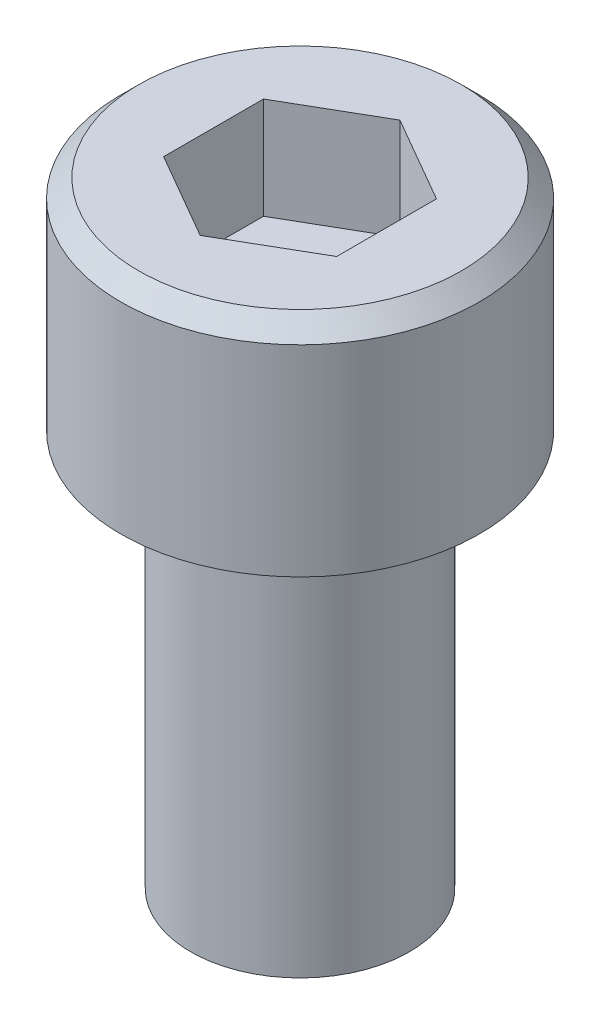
SolidWorks part; units mm, degrees
ref_plane "Plane1" through (0, 0, 0) normal (0, 0, 1) x (1, 0, 0)
ref_plane "Plane2" through (0, 0, 0) normal (0, 1, 0) x (1, 0, 0)
ref_plane "Plane3" through (0, 0, 0) normal (1, 0, 0) x (0, 0, -1)
sketch "Sketch1" plane through (0, 0, 0) normal (0, 0, 1) x (1, 0, 0)
  line L0 (0, 0) -> (2.8702, 0)
  line L1 (2.8702, 0) -> (2.8702, 3.2182)
  line L2 (2.8702, 3.2182) -> (2.5832, 3.5052)
  line L3 (2.5832, 3.5052) -> (0, 3.5052)
  line L4 (0, 3.5052) -> (0, 0)
  line L5 (0, 0) -> (0, 100) construction
revolve "Base-Revolve" add sketch "Sketch1" angle 360 about L5
sketch "Sketch2" plane through (0, 0, 0) normal (0, 0, 1) x (1, 0, 0)
  line L0 (0, 0) -> (0, 100) construction
  line L1 (0, -6.35) -> (1.7526, -6.35)
  line L2 (1.7526, -6.35) -> (1.7526, 0)
  line L3 (1.7526, 0) -> (0, 0)
  line L4 (0, 0) -> (0, -6.35)
revolve "Boss-Revolve1" add sketch "Sketch2" angle 360 about L0
ref_plane "Plane4" through (0, 3.5052, 0) normal (0, 1, 0) x (-1, 0, 0)
sketch "Sketch3" plane through (0, 3.5052, 0) normal (0, 1, 0) x (-1, 0, 0)
  line L0 (1.3843, 0.7992) -> (0, 1.5985)
  line L1 (0, 1.5985) -> (-1.3843, 0.7992)
  line L2 (-1.3843, 0.7992) -> (-1.3843, -0.7992)
  line L3 (-1.3843, -0.7992) -> (0, -1.5985)
  line L4 (0, -1.5985) -> (1.3843, -0.7992)
  line L5 (1.3843, -0.7992) -> (1.3843, 0.7992)
extrude "Cut-Extrude1" cut sketch "Sketch3" against normal blind 1.6256
